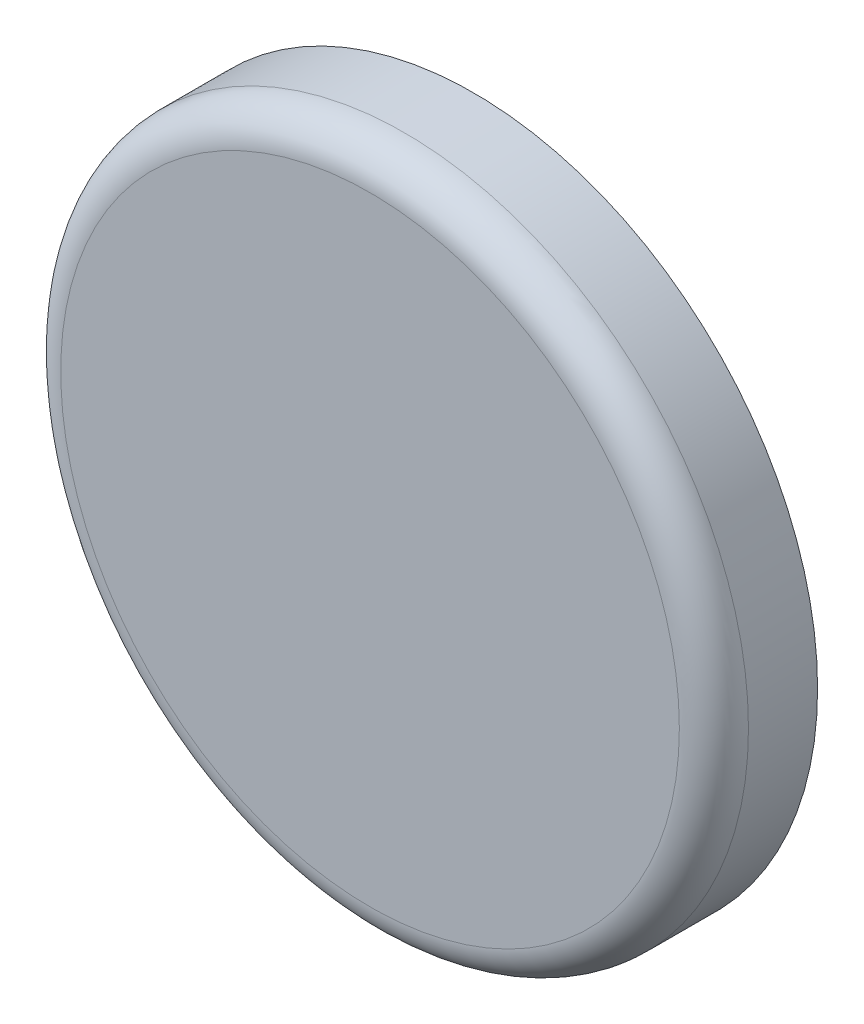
SolidWorks part; units mm, degrees
ref_plane "Front Plane" through (0, 0, 0) normal (0, 0, 1) x (1, 0, 0)
ref_plane "Top Plane" through (0, 0, 0) normal (0, 1, 0) x (1, 0, 0)
ref_plane "Right Plane" through (0, 0, 0) normal (1, 0, 0) x (0, 0, -1)
sketch "Sketch1" plane through (0, 0, 0) normal (0, 0, 1) x (1, 0, 0)
  circle A0 centre (0, 0) radius 9.95
  dimension "D1" = 19.9
extrude "Boss-Extrude1" add sketch "Sketch1" along normal blind 3
fillet "Fillet1" radius 1 1 edges at (9.95, 0, 3)
